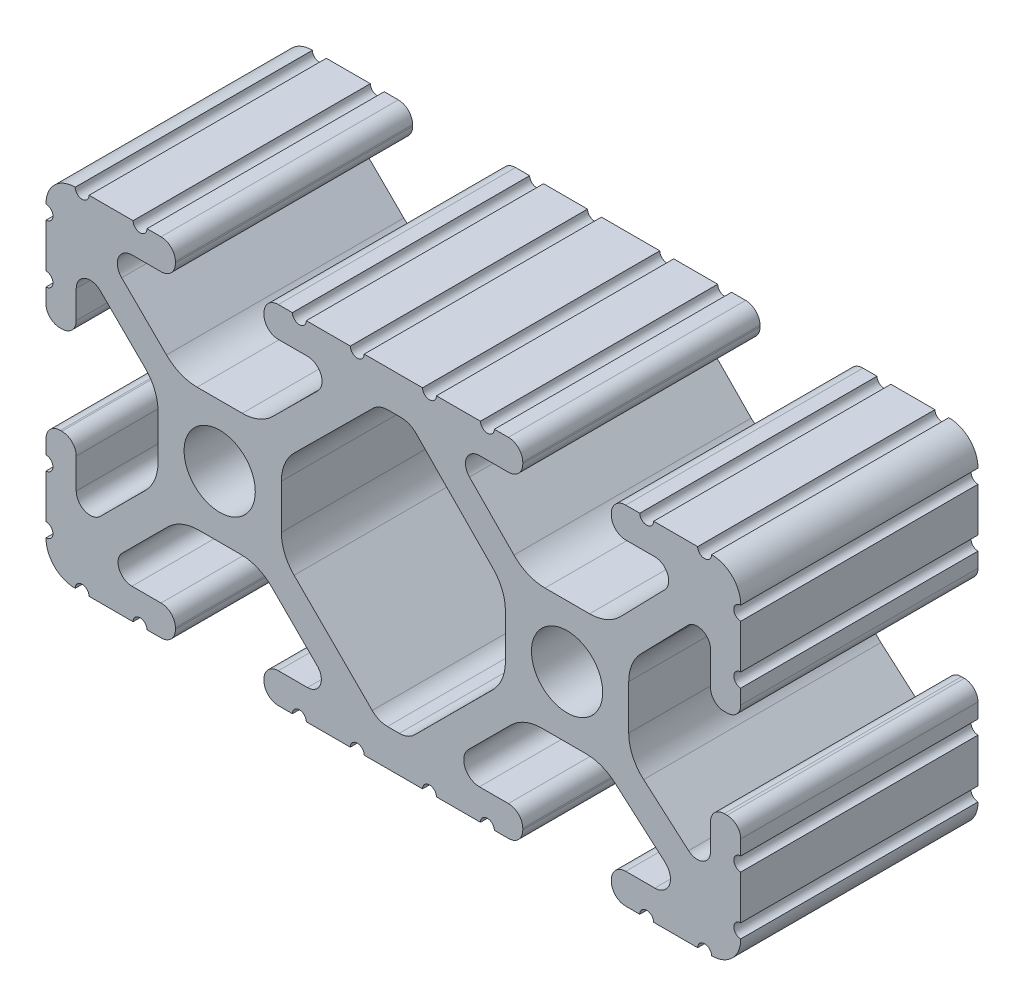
SolidWorks part; units mm, degrees
ref_plane "Front" through (0, 0, 0) normal (0, 0, 1) x (1, 0, 0)
ref_plane "Top" through (0, 0, 0) normal (0, 1, 0) x (1, 0, 0)
ref_plane "Right" through (0, 0, 0) normal (1, 0, 0) x (0, 0, -1)
sketch "Sketch1" plane through (0, 0, 0) normal (0, 0, 1) x (1, 0, 0)
  line L0 (-20.1324, -9.4742) -> (-5.2676, -9.4742) construction
  line L16 (-7.2595, -3.8694) -> (-1.5457, -9.5728)
  line L17 (-8.1915, 1.6223) -> (-8.1915, -1.6223)
  line L18 (-1.504, 9.5765) -> (-7.252, 3.8768)
  line L19 (0.5515, 10.033) -> (-0.3952, 10.033)
  line L20 (7.2829, 3.8459) -> (1.6756, 9.5611)
  line L21 (8.1915, -1.6223) -> (8.1915, 1.6223)
  line L22 (1.5457, -9.5728) -> (7.2595, -3.8694)
  line L23 (-0.4332, -10.033) -> (0.4332, -10.033)
  line L136 (18.0171, 12.7) -> (16.9875, 12.7)
  line L137 (15.9385, 11.651) -> (15.9385, 11.5392)
  line L138 (16.9875, 10.4902) -> (19.1164, 10.4902)
  line L139 (19.8441, 8.7652) -> (16.619, 5.4551)
  line L140 (14.3449, 4.4958) -> (11.0833, 4.4958)
  line L141 (8.817, 5.4472) -> (5.5642, 8.7627)
  line L142 (6.2894, 10.4902) -> (8.4125, 10.4902)
  line L143 (9.4615, 11.5392) -> (9.4615, 11.651)
  line L144 (8.4125, 12.7) -> (7.3829, 12.7)
  line L145 (6.3669, 12.7) -> (3.1496, 12.7)
  line L146 (2.1336, 12.7) -> (-2.1336, 12.7)
  line L147 (-3.1496, 12.7) -> (-6.3669, 12.7)
  line L148 (-7.3829, 12.7) -> (-8.4125, 12.7)
  line L149 (-9.4615, 11.651) -> (-9.4615, 11.5392)
  line L150 (-8.4125, 10.4902) -> (-6.2836, 10.4902)
  line L151 (-5.5326, 8.6661) -> (-8.81, 5.4163)
  line L152 (-11.0455, 4.4958) -> (-14.3545, 4.4958)
  line L153 (-16.59, 5.4163) -> (-19.8674, 8.6661)
  line L154 (-19.1164, 10.4902) -> (-16.9875, 10.4902)
  line L155 (-15.9385, 11.5392) -> (-15.9385, 11.651)
  line L156 (-16.9875, 12.7) -> (-18.0171, 12.7)
  line L157 (-19.0331, 12.7) -> (-22.2504, 12.7)
  line L158 (-25.4, 9.5504) -> (-25.4, 6.3331)
  line L159 (-25.4, 5.3171) -> (-25.4, 4.2375)
  line L160 (-24.401, 3.2385) -> (-24.2392, 3.2385)
  line L161 (-23.1902, 4.2875) -> (-23.1902, 6.3347)
  line L162 (-21.434, 7.0665) -> (-18.148, 3.8082)
  line L163 (-17.2085, 1.5536) -> (-17.2085, -1.6952)
  line L164 (-18.1405, -3.9423) -> (-21.4316, -7.2274)
  line L165 (-23.1902, -6.498) -> (-23.1902, -4.2875)
  line L166 (-24.2392, -3.2385) -> (-24.351, -3.2385)
  line L167 (-25.4, -4.2875) -> (-25.4, -5.3171)
  line L168 (-25.4, -6.3331) -> (-25.4, -9.5504)
  line L169 (-22.2504, -12.7) -> (-19.0331, -12.7)
  line L170 (-18.0171, -12.7) -> (-16.9875, -12.7)
  line L171 (-15.9384, -11.651) -> (-15.9384, -11.5392)
  line L172 (-16.9875, -10.4902) -> (-19.1164, -10.4902)
  line L173 (-19.8341, -8.7551) -> (-16.4966, -5.4237)
  line L174 (-14.2536, -4.4958) -> (-11.1464, -4.4958)
  line L175 (-8.9034, -5.4237) -> (-5.5659, -8.7551)
  line L176 (-6.2836, -10.4902) -> (-8.4125, -10.4902)
  line L177 (-9.4616, -11.5392) -> (-9.4616, -11.651)
  line L178 (-8.4125, -12.7) -> (-7.3829, -12.7)
  line L179 (-6.3669, -12.7) -> (-3.1496, -12.7)
  line L180 (-2.1336, -12.7) -> (2.1336, -12.7)
  line L181 (3.1496, -12.7) -> (6.3669, -12.7)
  line L182 (7.3829, -12.7) -> (8.4125, -12.7)
  line L183 (9.4616, -11.651) -> (9.4616, -11.5392)
  line L184 (8.4125, -10.4902) -> (6.2894, -10.4902)
  line L185 (5.4807, -8.5353) -> (8.5979, -5.4237)
  line L186 (10.8409, -4.4958) -> (14.1026, -4.4958)
  line L187 (16.1879, -5.2766) -> (19.8682, -8.4822)
  line L188 (19.1164, -10.4902) -> (16.9875, -10.4902)
  line L189 (15.9384, -11.5392) -> (15.9384, -11.651)
  line L190 (16.9875, -12.7) -> (18.0171, -12.7)
  line L191 (19.0331, -12.7) -> (22.2504, -12.7)
  line L192 (25.4, -9.5504) -> (25.4, -6.3331)
  line L193 (25.4, -5.3171) -> (25.4, -4.2375)
  line L194 (24.401, -3.2385) -> (24.1892, -3.2385)
  line L195 (23.1902, -4.2375) -> (23.1902, -6.1559)
  line L196 (21.584, -6.8869) -> (18.2982, -4.025)
  line L197 (17.2085, -1.6308) -> (17.2085, 1.6308)
  line L198 (18.1094, 3.8465) -> (21.5263, 7.3534)
  line L199 (23.1902, 6.6769) -> (23.1902, 4.2375)
  line L200 (24.1892, 3.2385) -> (24.401, 3.2385)
  line L201 (25.4, 4.2375) -> (25.4, 5.3171)
  line L202 (25.4, 6.3332) -> (25.4, 9.5504)
  line L203 (22.2504, 12.7) -> (19.0331, 12.7)
  circle A2 centre (-12.7, 0) radius 2.6035
  circle A4 centre (12.7, 0) radius 2.6035
  arc A18 (-1.5457, -9.5728) -> (-0.4332, -10.033) centre (-0.4332, -8.4582) ccw
  arc A19 (-8.1915, -1.6223) -> (-7.2595, -3.8694) centre (-5.0165, -1.6223) ccw
  arc A20 (-7.252, 3.8768) -> (-8.1915, 1.6223) centre (-5.0165, 1.6223) ccw
  arc A21 (-0.3952, 10.033) -> (-1.504, 9.5765) centre (-0.3952, 8.4582) ccw
  arc A22 (1.6756, 9.5611) -> (0.5515, 10.033) centre (0.5515, 8.4582) ccw
  arc A23 (8.1915, 1.6223) -> (7.2829, 3.8459) centre (5.0165, 1.6223) ccw
  arc A24 (7.2595, -3.8694) -> (8.1915, -1.6223) centre (5.0165, -1.6223) ccw
  arc A25 (0.4332, -10.033) -> (1.5457, -9.5728) centre (0.4332, -8.4582) ccw
  arc A152 (18.0171, 12.7) -> (19.0331, 12.7) centre (18.5251, 12.7) ccw
  arc A153 (16.9875, 12.7) -> (15.9385, 11.651) centre (16.9875, 11.651) ccw
  arc A154 (15.9385, 11.5392) -> (16.9875, 10.4902) centre (16.9875, 11.5392) ccw
  arc A155 (19.8441, 8.7652) -> (19.1164, 10.4902) centre (19.1164, 9.4742) ccw
  arc A156 (14.3449, 4.4958) -> (16.619, 5.4551) centre (14.3449, 7.6708) ccw
  arc A157 (8.817, 5.4472) -> (11.0833, 4.4958) centre (11.0833, 7.6708) ccw
  arc A158 (6.2894, 10.4902) -> (5.5642, 8.7627) centre (6.2894, 9.4742) ccw
  arc A159 (8.4125, 10.4902) -> (9.4615, 11.5392) centre (8.4125, 11.5392) ccw
  arc A160 (9.4615, 11.651) -> (8.4125, 12.7) centre (8.4125, 11.651) ccw
  arc A161 (6.3669, 12.7) -> (7.3829, 12.7) centre (6.8749, 12.7) ccw
  arc A162 (2.1336, 12.7) -> (3.1496, 12.7) centre (2.6416, 12.7) ccw
  arc A163 (-3.1496, 12.7) -> (-2.1336, 12.7) centre (-2.6416, 12.7) ccw
  arc A164 (-7.3829, 12.7) -> (-6.3669, 12.7) centre (-6.8749, 12.7) ccw
  arc A165 (-8.4125, 12.7) -> (-9.4615, 11.651) centre (-8.4125, 11.651) ccw
  arc A166 (-9.4615, 11.5392) -> (-8.4125, 10.4902) centre (-8.4125, 11.5392) ccw
  arc A167 (-5.5326, 8.6661) -> (-6.2836, 10.4902) centre (-6.2836, 9.4235) ccw
  arc A168 (-11.0455, 4.4958) -> (-8.81, 5.4163) centre (-11.0455, 7.6708) ccw
  arc A169 (-16.59, 5.4163) -> (-14.3545, 4.4958) centre (-14.3545, 7.6708) ccw
  arc A170 (-19.1164, 10.4902) -> (-19.8674, 8.6661) centre (-19.1164, 9.4235) ccw
  arc A171 (-16.9875, 10.4902) -> (-15.9385, 11.5392) centre (-16.9875, 11.5392) ccw
  arc A172 (-15.9385, 11.651) -> (-16.9875, 12.7) centre (-16.9875, 11.651) ccw
  arc A173 (-19.0331, 12.7) -> (-18.0171, 12.7) centre (-18.5251, 12.7) ccw
  arc A174 (-23.2664, 12.6998) -> (-22.2504, 12.7) centre (-22.7584, 12.7) ccw
  arc A175 (-23.2664, 12.6998) -> (-25.3998, 10.5664) centre (-23.2918, 10.5918) ccw
  arc A176 (-25.4, 9.5504) -> (-25.3998, 10.5664) centre (-25.4, 10.0584) ccw
  arc A177 (-25.4, 5.3171) -> (-25.4, 6.3331) centre (-25.4, 5.8251) ccw
  arc A178 (-25.4, 4.2375) -> (-24.401, 3.2385) centre (-24.401, 4.2375) ccw
  arc A179 (-24.2392, 3.2385) -> (-23.1902, 4.2875) centre (-24.2392, 4.2875) ccw
  arc A180 (-21.434, 7.0665) -> (-23.1902, 6.3347) centre (-22.1596, 6.3347) ccw
  arc A181 (-17.2085, 1.5536) -> (-18.148, 3.8082) centre (-20.3835, 1.5536) ccw
  arc A182 (-18.1405, -3.9423) -> (-17.2085, -1.6952) centre (-20.3835, -1.6952) ccw
  arc A183 (-23.1902, -6.498) -> (-21.4316, -7.2274) centre (-22.1596, -6.498) ccw
  arc A184 (-23.1902, -4.2875) -> (-24.2392, -3.2385) centre (-24.2392, -4.2875) ccw
  arc A185 (-24.351, -3.2385) -> (-25.4, -4.2875) centre (-24.351, -4.2875) ccw
  arc A186 (-25.4, -6.3331) -> (-25.4, -5.3171) centre (-25.4, -5.8251) ccw
  arc A187 (-25.3998, -10.5664) -> (-25.4, -9.5504) centre (-25.4, -10.0584) ccw
  arc A188 (-25.3998, -10.5664) -> (-23.2664, -12.6998) centre (-23.2918, -10.5918) ccw
  arc A189 (-22.2504, -12.7) -> (-23.2664, -12.6998) centre (-22.7584, -12.7) ccw
  arc A190 (-18.0171, -12.7) -> (-19.0331, -12.7) centre (-18.5251, -12.7) ccw
  arc A191 (-16.9875, -12.7) -> (-15.9384, -11.651) centre (-16.9875, -11.651) ccw
  arc A192 (-15.9384, -11.5392) -> (-16.9875, -10.4902) centre (-16.9875, -11.5392) ccw
  arc A193 (-19.8341, -8.7551) -> (-19.1164, -10.4902) centre (-19.1164, -9.4742) ccw
  arc A194 (-14.2536, -4.4958) -> (-16.4966, -5.4237) centre (-14.2536, -7.6708) ccw
  arc A195 (-8.9034, -5.4237) -> (-11.1464, -4.4958) centre (-11.1464, -7.6708) ccw
  arc A196 (-6.2836, -10.4902) -> (-5.5659, -8.7551) centre (-6.2836, -9.4742) ccw
  arc A197 (-8.4125, -10.4902) -> (-9.4616, -11.5392) centre (-8.4125, -11.5392) ccw
  arc A198 (-9.4616, -11.651) -> (-8.4125, -12.7) centre (-8.4125, -11.651) ccw
  arc A199 (-6.3669, -12.7) -> (-7.3829, -12.7) centre (-6.8749, -12.7) ccw
  arc A200 (-2.1336, -12.7) -> (-3.1496, -12.7) centre (-2.6416, -12.7) ccw
  arc A201 (3.1496, -12.7) -> (2.1336, -12.7) centre (2.6416, -12.7) ccw
  arc A202 (7.3829, -12.7) -> (6.3669, -12.7) centre (6.8749, -12.7) ccw
  arc A203 (8.4125, -12.7) -> (9.4616, -11.651) centre (8.4125, -11.651) ccw
  arc A204 (9.4616, -11.5392) -> (8.4125, -10.4902) centre (8.4125, -11.5392) ccw
  arc A205 (5.4807, -8.5353) -> (6.2894, -10.4902) centre (6.2894, -9.3455) ccw
  arc A206 (10.8409, -4.4958) -> (8.5979, -5.4237) centre (10.8409, -7.6708) ccw
  arc A207 (16.1879, -5.2766) -> (14.1026, -4.4958) centre (14.1026, -7.6708) ccw
  arc A208 (19.1164, -10.4902) -> (19.8682, -8.4822) centre (19.1164, -9.3455) ccw
  arc A209 (16.9875, -10.4902) -> (15.9384, -11.5392) centre (16.9875, -11.5392) ccw
  arc A210 (15.9384, -11.651) -> (16.9875, -12.7) centre (16.9875, -11.651) ccw
  arc A211 (19.0331, -12.7) -> (18.0171, -12.7) centre (18.5251, -12.7) ccw
  arc A212 (23.2664, -12.6998) -> (22.2504, -12.7) centre (22.7584, -12.7) ccw
  arc A213 (23.2664, -12.6998) -> (25.3998, -10.5664) centre (23.2918, -10.5918) ccw
  arc A214 (25.4, -9.5504) -> (25.3998, -10.5664) centre (25.4, -10.0584) ccw
  arc A215 (25.4, -5.3171) -> (25.4, -6.3331) centre (25.4, -5.8251) ccw
  arc A216 (25.4, -4.2375) -> (24.401, -3.2385) centre (24.401, -4.2375) ccw
  arc A217 (24.1892, -3.2385) -> (23.1902, -4.2375) centre (24.1892, -4.2375) ccw
  arc A218 (21.584, -6.8869) -> (23.1902, -6.1559) centre (22.2207, -6.1559) ccw
  arc A219 (17.2085, -1.6308) -> (18.2982, -4.025) centre (20.3835, -1.6308) ccw
  arc A220 (18.1094, 3.8465) -> (17.2085, 1.6308) centre (20.3835, 1.6308) ccw
  arc A221 (23.1902, 6.6769) -> (21.5263, 7.3534) centre (22.2207, 6.6769) ccw
  arc A222 (23.1902, 4.2375) -> (24.1892, 3.2385) centre (24.1892, 4.2375) ccw
  arc A223 (24.401, 3.2385) -> (25.4, 4.2375) centre (24.401, 4.2375) ccw
  arc A224 (25.4, 6.3332) -> (25.4, 5.3171) centre (25.4, 5.8251) ccw
  arc A225 (25.3998, 10.5664) -> (25.4, 9.5504) centre (25.4, 10.0584) ccw
  arc A226 (25.3998, 10.5664) -> (23.2664, 12.6998) centre (23.2918, 10.5918) ccw
  arc A227 (22.2504, 12.7) -> (23.2664, 12.6998) centre (22.7584, 12.7) ccw
extrude "Boss-Extrude1" add sketch "Sketch1" along normal mid plane 17.3482
